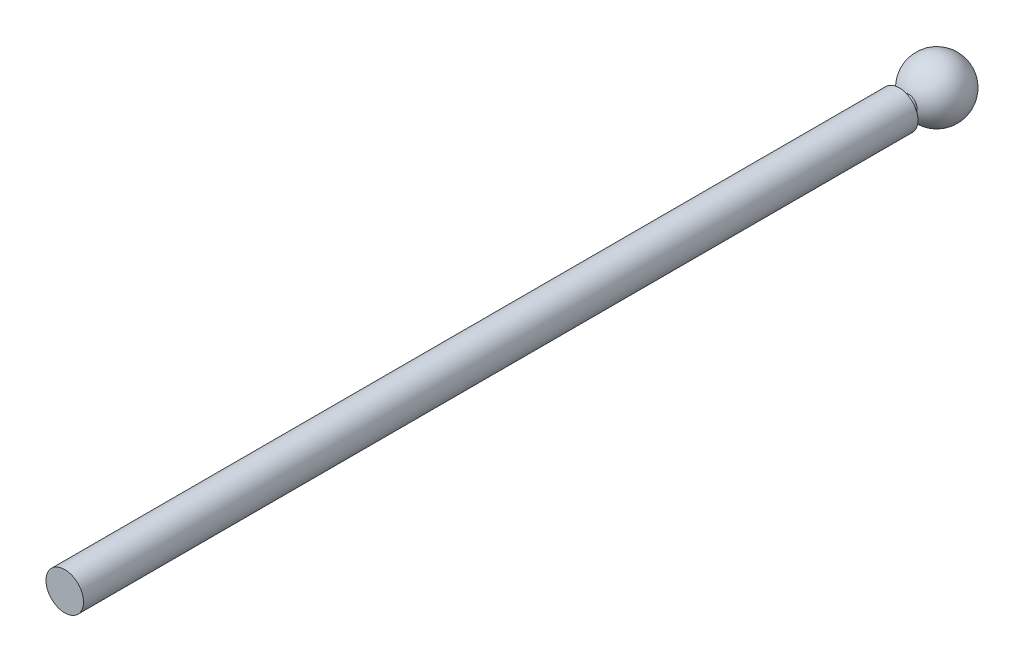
SolidWorks part; units mm, degrees
ref_plane "正面" through (0, 0, 0) normal (0, 0, 1) x (1, 0, 0)
ref_plane "平面" through (0, 0, 0) normal (0, 1, 0) x (1, 0, 0)
ref_plane "右側面" through (0, 0, 0) normal (1, 0, 0) x (0, 0, -1)
sketch "ｽｹｯﾁ1" plane through (0, 0, 0) normal (0, 0, 1) x (1, 0, 0)
  line L0 (0, 75.9872) -> (0, -101.9193) construction
  line L1 (0, 35) -> (0, -35)
  arc A0 (0, 35) -> (0, -35) centre (0, 0) cw
  dimension "D1" = 35
revolve "回転1" add sketch "ｽｹｯﾁ1" angle 360 about L0
sketch "ｽｹｯﾁ2" plane through (0, 0, 0) normal (0, 0, 1) x (1, 0, 0)
  circle A0 centre (0, 0) radius 10
  dimension "D1" = 20
extrude "押し出し1" add sketch "ｽｹｯﾁ2" along normal blind 45
sketch "ｽｹｯﾁ3" plane through (0, 0, 45) normal (0, 0, 1) x (1, 0, 0)
  circle A0 centre (0, 0) radius 22.5
  dimension "D1" = 45
extrude "押し出し2" add sketch "ｽｹｯﾁ3" along normal blind 1000
